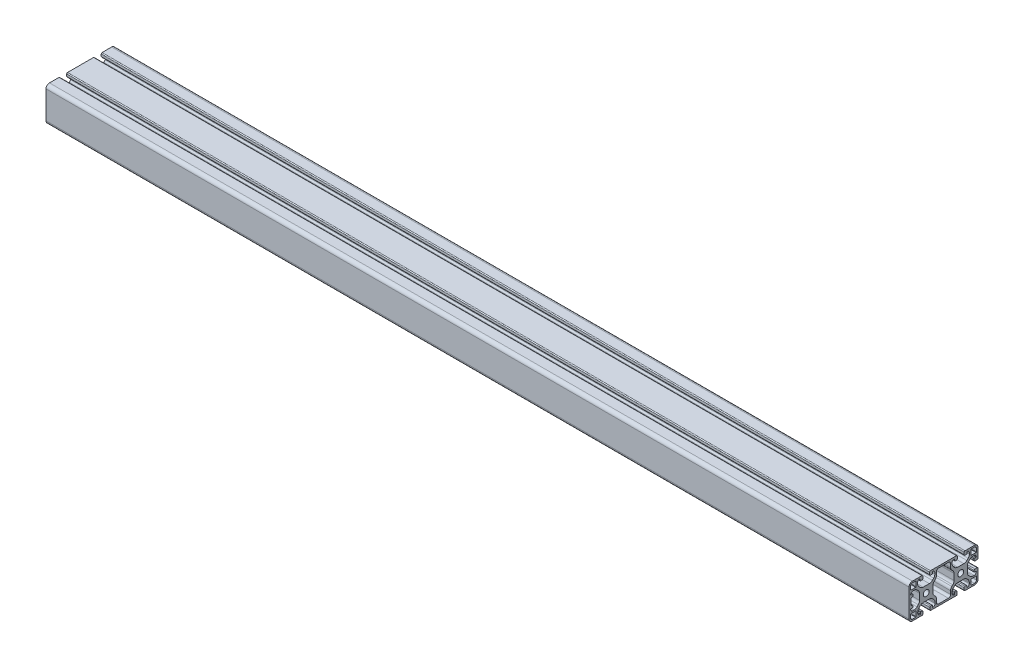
SolidWorks part; units mm, degrees
ref_plane "Ebene vorne" through (0, 0, 0) normal (0, 0, 1) x (1, 0, 0)
ref_plane "Ebene oben" through (0, 0, 0) normal (0, 1, 0) x (1, 0, 0)
ref_plane "Ebene rechts" through (0, 0, 0) normal (1, 0, 0) x (0, 0, -1)
sketch "Skizze1" plane through (0, 0, 0) normal (0, 1, 0) x (1, 0, 0)
  line L0 (0, 0) -> (1000, 0)
  dimension "D1" = 1000
other "Strukturbauteil1"
ref_plane "Ebene1" through (0, 0, 0) normal (1, 0, 0) x (0, 0, -1)
sketch "Skizze11" plane through (0, 0, 0) normal (1, 0, 0) x (0, 0, -1)
  line L0 (-15.8539, -17.6112) -> (-15.8539, -19.11)
  line L1 (23.846, -17.4921) -> (23.846, -19.1092)
  line L2 (15.7426, -17.5) -> (15.7426, -19.11)
  line L3 (-23.9651, -17.5) -> (-23.9651, -19.11)
  line L4 (9.5184, -8.2142) -> (10.6394, -7.0931)
  line L5 (8.0539, -15.5) -> (8.0539, -11.7497)
  line L6 (-5.8461, -18) -> (5.5539, -18)
  line L7 (-8.3461, -11.7497) -> (-8.3461, -15.5)
  line L8 (-14.9639, -20) -> (14.8526, -20)
  line L9 (24.7368, -20) -> (35.8539, -20)
  line L11 (-37.8961, -3.505) -> (-37.8961, 3.505)
  line L12 (-10.9316, -7.0931) -> (-9.8106, -8.2142)
  line L13 (-12.3961, 3.5576) -> (-12.3961, -3.5576)
  line L14 (-9.8106, 8.2142) -> (-10.9316, 7.0931)
  line L15 (-8.3461, 15.5) -> (-8.3461, 11.7497)
  line L16 (5.5539, 18) -> (-5.8461, 18)
  line L17 (8.0539, 11.7497) -> (8.0539, 15.5)
  line L18 (10.6394, 7.0931) -> (9.5184, 8.2142)
  line L19 (12.1039, -3.5576) -> (12.1039, 3.5576)
  line L24 (23.3003, -7.75) -> (16.185, -7.75)
  line L25 (37.5539, -11.8) -> (32.1539, -11.8)
  line L26 (-32.4461, -11.8) -> (-37.8461, -11.8)
  line L27 (-40.1461, 16) -> (-40.1461, -16)
  line L28 (-36.1461, -20) -> (-24.8551, -20)
  line L29 (39.8539, -16) -> (39.8539, -5)
  line L30 (38.8539, -4) -> (36.3539, -4)
  line L31 (35.3539, -5) -> (35.3539, -6.5)
  line L32 (35.8539, -7) -> (37.4039, -7)
  line L33 (37.8539, -7.45) -> (37.8539, -7.5)
  line L34 (35.3539, -10) -> (34.0463, -10)
  line L35 (30.5107, -8.5355) -> (29.0684, -7.0931)
  line L36 (27.6039, -3.5576) -> (27.6039, 3.5576)
  line L37 (29.0684, 7.0931) -> (30.5107, 8.5355)
  line L38 (34.0463, 10) -> (35.3539, 10)
  line L39 (37.8539, 7.5) -> (37.8539, 7.45)
  line L40 (37.4039, 7) -> (35.8539, 7)
  line L41 (35.3539, 6.5) -> (35.3539, 5)
  line L42 (36.3539, 4) -> (38.8539, 4)
  line L43 (39.8539, 5) -> (39.8539, 16)
  line L44 (35.8539, 20) -> (24.8539, 20)
  line L45 (23.8539, 19) -> (23.8539, 16.5)
  line L46 (24.8539, 15.5) -> (26.3539, 15.5)
  line L47 (26.8539, 16) -> (26.8539, 17.55)
  line L48 (27.3039, 18) -> (27.3539, 18)
  line L49 (29.8539, 15.5) -> (29.8539, 14.1924)
  line L50 (28.3894, 10.6569) -> (26.947, 9.2145)
  line L51 (23.4115, 7.75) -> (16.2963, 7.75)
  line L52 (12.7607, 9.2145) -> (11.3184, 10.6569)
  line L53 (9.8539, 14.1924) -> (9.8539, 15.5)
  line L54 (12.3539, 18) -> (12.4039, 18)
  line L55 (12.8539, 17.55) -> (12.8539, 16)
  line L56 (13.3539, 15.5) -> (14.8539, 15.5)
  line L57 (15.8539, 16.5) -> (15.8539, 19)
  line L58 (14.8539, 20) -> (-15.1461, 20)
  line L59 (-16.1461, 19) -> (-16.1461, 16.5)
  line L60 (-15.1461, 15.5) -> (-13.6461, 15.5)
  line L61 (-13.1461, 16) -> (-13.1461, 17.55)
  line L62 (-12.6961, 18) -> (-12.6461, 18)
  line L63 (-10.1461, 15.5) -> (-10.1461, 14.1924)
  line L64 (-11.6106, 10.6569) -> (-13.053, 9.2145)
  line L65 (-16.5885, 7.75) -> (-23.7037, 7.75)
  line L66 (-27.2392, 9.2145) -> (-28.6816, 10.6569)
  line L67 (-30.1461, 14.1924) -> (-30.1461, 15.5)
  line L68 (-27.6461, 18) -> (-27.5961, 18)
  line L69 (-27.1461, 17.55) -> (-27.1461, 16)
  line L70 (-26.6461, 15.5) -> (-25.1461, 15.5)
  line L71 (-24.1461, 16.5) -> (-24.1461, 19)
  line L72 (-25.1461, 20) -> (-36.1461, 20)
  line L74 (-37.4561, 3.945) -> (-36.6461, 3.945)
  line L75 (-35.6461, 4.945) -> (-35.6461, 6.445)
  line L76 (-36.1461, 6.945) -> (-37.6961, 6.945)
  line L77 (-38.1461, 7.395) -> (-38.1461, 7.445)
  line L78 (-35.6461, 9.945) -> (-34.3385, 9.945)
  line L79 (-30.803, 8.4805) -> (-29.3606, 7.0381)
  line L80 (-27.8961, 3.6126) -> (-27.8961, -3.5026)
  line L81 (-29.3606, -7.0381) -> (-30.803, -8.4805)
  line L82 (-34.3385, -9.945) -> (-35.6461, -9.945)
  line L83 (-38.1461, -7.445) -> (-38.1461, -7.395)
  line L84 (-37.6961, -6.945) -> (-36.1461, -6.945)
  line L85 (-35.6461, -6.445) -> (-35.6461, -4.945)
  line L86 (-36.6461, -3.945) -> (-37.4561, -3.945)
  line L87 (-14.8539, -15.6112) -> (-13.3539, -15.6112)
  line L88 (-29.9651, -14.1924) -> (-29.9651, -15.5)
  line L89 (-27.0583, -9.2145) -> (-28.5007, -10.6569)
  line L90 (-16.4075, -7.75) -> (-23.5228, -7.75)
  line L91 (-11.4296, -10.6569) -> (-12.872, -9.2145)
  line L92 (-9.9651, -15.5) -> (-9.9651, -14.1924)
  line L93 (-12.8539, -16.1112) -> (-12.8539, -17.6112)
  line L95 (-15.8539, -17.6112) -> (-15.8539, -16.6112)
  line L96 (-23.9651, -16.5) -> (-23.9651, -17.5)
  line L97 (-26.4651, -15.5) -> (-24.9651, -15.5)
  line L98 (-26.9651, -17.5) -> (-26.9651, -16)
  line L99 (31.6539, -12.3) -> (31.6539, -17.7)
  line L100 (9.7426, -14.1924) -> (9.7426, -15.5)
  line L101 (12.6495, -9.2145) -> (11.2071, -10.6569)
  line L103 (28.2782, -10.6569) -> (26.8358, -9.2145)
  line L104 (29.7426, -15.5) -> (29.7426, -14.1924)
  line L105 (26.846, -15.9921) -> (26.846, -17.4921)
  line L106 (24.846, -15.4921) -> (26.346, -15.4921)
  line L107 (23.846, -17.4921) -> (23.846, -16.4921)
  line L108 (15.7426, -16.5) -> (15.7426, -17.5)
  line L109 (13.2426, -15.5) -> (14.7426, -15.5)
  line L110 (12.7426, -17.5) -> (12.7426, -16)
  line L112 (38.0539, -16) -> (38.0539, -12.3)
  line L113 (32.1539, -18.2) -> (35.8539, -18.2)
  line L114 (-38.3461, 16) -> (-38.3461, 12.3)
  line L115 (-32.4461, 18.2) -> (-36.1461, 18.2)
  line L116 (-31.9461, 12.3) -> (-31.9461, 17.7)
  line L117 (-37.8461, 11.8) -> (-32.4461, 11.8)
  line L118 (31.6539, 17.7) -> (31.6539, 12.3)
  line L119 (35.8539, 18.2) -> (32.1539, 18.2)
  line L120 (38.0539, 12.3) -> (38.0539, 16)
  line L121 (32.1539, 11.8) -> (37.5539, 11.8)
  line L123 (-31.9461, -17.7) -> (-31.9461, -12.3)
  line L124 (-36.1461, -18.2) -> (-32.4461, -18.2)
  line L125 (-38.3461, -12.3) -> (-38.3461, -16)
  arc A0 (-37.4561, 3.945) -> (-37.8961, 3.505) centre (-37.4039, 3.4528) ccw
  arc A1 (-37.4561, -3.945) -> (-37.8961, -3.505) centre (-37.4039, -3.4528) cw
  arc A2 (14.8526, -20) -> (15.7426, -19.11) centre (14.747, -19.0043) ccw
  arc A3 (24.7368, -20) -> (23.846, -19.1092) centre (24.7368, -19.1092) cw
  arc A4 (-23.9651, -19.11) -> (-24.8551, -20) centre (-24.9608, -19.0043) cw
  arc A5 (-14.9639, -20) -> (-15.8539, -19.11) centre (-14.8582, -19.0043) cw
  arc A6 (10.6394, -7.0931) -> (12.1039, -3.5576) centre (7.1039, -3.5576) ccw
  arc A7 (9.5184, -8.2142) -> (8.0539, -11.7497) centre (13.0539, -11.7497) ccw
  arc A8 (5.5539, -18) -> (8.0539, -15.5) centre (5.5539, -15.5) ccw
  arc A9 (-8.3461, -15.5) -> (-5.8461, -18) centre (-5.8461, -15.5) ccw
  arc A11 (-12.3961, -3.5576) -> (-10.9316, -7.0931) centre (-7.3961, -3.5576) ccw
  arc A12 (-8.3461, -11.7497) -> (-9.8106, -8.2142) centre (-13.3461, -11.7497) ccw
  arc A14 (-10.9316, 7.0931) -> (-12.3961, 3.5576) centre (-7.3961, 3.5576) ccw
  arc A15 (-9.8106, 8.2142) -> (-8.3461, 11.7497) centre (-13.3461, 11.7497) ccw
  arc A16 (-5.8461, 18) -> (-8.3461, 15.5) centre (-5.8461, 15.5) ccw
  arc A17 (8.0539, 15.5) -> (5.5539, 18) centre (5.5539, 15.5) ccw
  arc A18 (8.0539, 11.7497) -> (9.5184, 8.2142) centre (13.0539, 11.7497) ccw
  arc A19 (12.1039, 3.5576) -> (10.6394, 7.0931) centre (7.1039, 3.5576) ccw
  circle A24 centre (-20.1461, 0) radius 3.4
  circle A25 centre (19.8539, 0) radius 3.4
  arc A26 (16.185, -7.75) -> (12.6495, -9.2145) centre (16.185, -12.75) ccw
  arc A27 (-40.1461, -16) -> (-36.1461, -20) centre (-36.1461, -16) ccw
  arc A28 (35.8539, -20) -> (39.8539, -16) centre (35.8539, -16) ccw
  arc A29 (39.8539, -5) -> (38.8539, -4) centre (38.8539, -5) ccw
  arc A30 (36.3539, -4) -> (35.3539, -5) centre (36.3539, -5) ccw
  arc A31 (35.3539, -6.5) -> (35.8539, -7) centre (35.8539, -6.5) ccw
  arc A32 (37.8539, -7.45) -> (37.4039, -7) centre (37.4039, -7.45) ccw
  arc A33 (35.3539, -10) -> (37.8539, -7.5) centre (35.3539, -7.5) ccw
  arc A34 (30.5107, -8.5355) -> (34.0463, -10) centre (34.0463, -5) ccw
  arc A35 (27.6039, -3.5576) -> (29.0684, -7.0931) centre (32.6039, -3.5576) ccw
  arc A36 (29.0684, 7.0931) -> (27.6039, 3.5576) centre (32.6039, 3.5576) ccw
  arc A37 (34.0463, 10) -> (30.5107, 8.5355) centre (34.0463, 5) ccw
  arc A38 (37.8539, 7.5) -> (35.3539, 10) centre (35.3539, 7.5) ccw
  arc A39 (37.4039, 7) -> (37.8539, 7.45) centre (37.4039, 7.45) ccw
  arc A40 (35.8539, 7) -> (35.3539, 6.5) centre (35.8539, 6.5) ccw
  arc A41 (35.3539, 5) -> (36.3539, 4) centre (36.3539, 5) ccw
  arc A42 (38.8539, 4) -> (39.8539, 5) centre (38.8539, 5) ccw
  arc A43 (39.8539, 16) -> (35.8539, 20) centre (35.8539, 16) ccw
  arc A44 (24.8539, 20) -> (23.8539, 19) centre (24.8539, 19) ccw
  arc A45 (23.8539, 16.5) -> (24.8539, 15.5) centre (24.8539, 16.5) ccw
  arc A46 (26.3539, 15.5) -> (26.8539, 16) centre (26.3539, 16) ccw
  arc A47 (27.3039, 18) -> (26.8539, 17.55) centre (27.3039, 17.55) ccw
  arc A48 (29.8539, 15.5) -> (27.3539, 18) centre (27.3539, 15.5) ccw
  arc A49 (28.3894, 10.6569) -> (29.8539, 14.1924) centre (24.8539, 14.1924) ccw
  arc A50 (23.4115, 7.75) -> (26.947, 9.2145) centre (23.4115, 12.75) ccw
  arc A51 (12.7607, 9.2145) -> (16.2963, 7.75) centre (16.2963, 12.75) ccw
  arc A52 (9.8539, 14.1924) -> (11.3184, 10.6569) centre (14.8539, 14.1924) ccw
  arc A53 (12.3539, 18) -> (9.8539, 15.5) centre (12.3539, 15.5) ccw
  arc A54 (12.8539, 17.55) -> (12.4039, 18) centre (12.4039, 17.55) ccw
  arc A55 (12.8539, 16) -> (13.3539, 15.5) centre (13.3539, 16) ccw
  arc A56 (14.8539, 15.5) -> (15.8539, 16.5) centre (14.8539, 16.5) ccw
  arc A57 (15.8539, 19) -> (14.8539, 20) centre (14.8539, 19) ccw
  arc A58 (-15.1461, 20) -> (-16.1461, 19) centre (-15.1461, 19) ccw
  arc A59 (-16.1461, 16.5) -> (-15.1461, 15.5) centre (-15.1461, 16.5) ccw
  arc A60 (-13.6461, 15.5) -> (-13.1461, 16) centre (-13.6461, 16) ccw
  arc A61 (-12.6961, 18) -> (-13.1461, 17.55) centre (-12.6961, 17.55) ccw
  arc A62 (-10.1461, 15.5) -> (-12.6461, 18) centre (-12.6461, 15.5) ccw
  arc A63 (-11.6106, 10.6569) -> (-10.1461, 14.1924) centre (-15.1461, 14.1924) ccw
  arc A64 (-16.5885, 7.75) -> (-13.053, 9.2145) centre (-16.5885, 12.75) ccw
  arc A65 (-27.2392, 9.2145) -> (-23.7037, 7.75) centre (-23.7037, 12.75) ccw
  arc A66 (-30.1461, 14.1924) -> (-28.6816, 10.6569) centre (-25.1461, 14.1924) ccw
  arc A67 (-27.6461, 18) -> (-30.1461, 15.5) centre (-27.6461, 15.5) ccw
  arc A68 (-27.1461, 17.55) -> (-27.5961, 18) centre (-27.5961, 17.55) ccw
  arc A69 (-27.1461, 16) -> (-26.6461, 15.5) centre (-26.6461, 16) ccw
  arc A70 (-25.1461, 15.5) -> (-24.1461, 16.5) centre (-25.1461, 16.5) ccw
  arc A71 (-24.1461, 19) -> (-25.1461, 20) centre (-25.1461, 19) ccw
  arc A72 (-36.1461, 20) -> (-40.1461, 16) centre (-36.1461, 16) ccw
  arc A73 (-36.6461, 3.945) -> (-35.6461, 4.945) centre (-36.6461, 4.945) ccw
  arc A74 (-35.6461, 6.445) -> (-36.1461, 6.945) centre (-36.1461, 6.445) ccw
  arc A75 (-38.1461, 7.395) -> (-37.6961, 6.945) centre (-37.6961, 7.395) ccw
  arc A76 (-35.6461, 9.945) -> (-38.1461, 7.445) centre (-35.6461, 7.445) ccw
  arc A77 (-30.803, 8.4805) -> (-34.3385, 9.945) centre (-34.3385, 4.945) ccw
  arc A78 (-27.8961, 3.6126) -> (-29.3606, 7.0381) centre (-32.8949, 3.5014) ccw
  arc A79 (-29.3606, -7.0381) -> (-27.8961, -3.5026) centre (-32.8961, -3.5026) ccw
  arc A80 (-34.3385, -9.945) -> (-30.803, -8.4805) centre (-34.3385, -4.945) ccw
  arc A81 (-38.1461, -7.445) -> (-35.6461, -9.945) centre (-35.6461, -7.445) ccw
  arc A82 (-37.6961, -6.945) -> (-38.1461, -7.395) centre (-37.6961, -7.395) ccw
  arc A83 (-36.1461, -6.945) -> (-35.6461, -6.445) centre (-36.1461, -6.445) ccw
  arc A84 (-35.6461, -4.945) -> (-36.6461, -3.945) centre (-36.6461, -4.945) ccw
  arc A85 (-14.8539, -15.6112) -> (-15.8539, -16.6112) centre (-14.8539, -16.6112) ccw
  arc A86 (31.6539, -17.7) -> (32.1539, -18.2) centre (32.1539, -17.7) ccw
  arc A87 (32.1539, -11.8) -> (31.6539, -12.3) centre (32.1539, -12.3) ccw
  arc A88 (38.0539, -12.3) -> (37.5539, -11.8) centre (37.5539, -12.3) ccw
  arc A89 (35.8539, -18.2) -> (38.0539, -16) centre (35.8539, -16) ccw
  arc A90 (-29.9651, -15.5) -> (-27.4651, -18) centre (-27.4651, -15.5) ccw
  arc A91 (-28.5007, -10.6569) -> (-29.9651, -14.1924) centre (-24.9651, -14.1924) ccw
  arc A92 (-23.5228, -7.75) -> (-27.0583, -9.2145) centre (-23.5228, -12.75) ccw
  arc A93 (-12.872, -9.2145) -> (-16.4075, -7.75) centre (-16.4075, -12.75) ccw
  arc A94 (-9.9651, -14.1924) -> (-11.4296, -10.6569) centre (-14.9651, -14.1924) ccw
  arc A95 (-12.3539, -18.1112) -> (-9.9651, -15.5) centre (-12.4626, -15.6136) ccw
  arc A96 (-12.8539, -17.6112) -> (-12.3539, -18.1112) centre (-12.3539, -17.6112) ccw
  arc A97 (-12.8539, -16.1112) -> (-13.3539, -15.6112) centre (-13.3539, -16.1112) ccw
  arc A99 (-23.9651, -16.5) -> (-24.9651, -15.5) centre (-24.9651, -16.5) ccw
  arc A100 (-26.4651, -15.5) -> (-26.9651, -16) centre (-26.4651, -16) ccw
  arc A101 (-27.4651, -18) -> (-26.9651, -17.5) centre (-27.4651, -17.5) ccw
  arc A102 (9.7426, -15.5) -> (12.2426, -18) centre (12.2426, -15.5) ccw
  arc A103 (11.2071, -10.6569) -> (9.7426, -14.1924) centre (14.7426, -14.1924) ccw
  arc A105 (26.8358, -9.2145) -> (23.3003, -7.75) centre (23.3003, -12.75) ccw
  arc A106 (29.7426, -14.1924) -> (28.2782, -10.6569) centre (24.7426, -14.1924) ccw
  arc A107 (27.346, -17.9921) -> (29.7426, -15.5) centre (27.2427, -15.4942) ccw
  arc A108 (26.846, -17.4921) -> (27.346, -17.9921) centre (27.346, -17.4921) ccw
  arc A109 (26.846, -15.9921) -> (26.346, -15.4921) centre (26.346, -15.9921) ccw
  arc A110 (24.846, -15.4921) -> (23.846, -16.4921) centre (24.846, -16.4921) ccw
  arc A111 (15.7426, -16.5) -> (14.7426, -15.5) centre (14.7426, -16.5) ccw
  arc A112 (13.2426, -15.5) -> (12.7426, -16) centre (13.2426, -16) ccw
  arc A113 (12.2426, -18) -> (12.7426, -17.5) centre (12.2426, -17.5) ccw
  arc A114 (-38.3461, 12.3) -> (-37.8461, 11.8) centre (-37.8461, 12.3) ccw
  arc A115 (-36.1461, 18.2) -> (-38.3461, 16) centre (-36.1461, 16) ccw
  arc A116 (-31.9461, 17.7) -> (-32.4461, 18.2) centre (-32.4461, 17.7) ccw
  arc A117 (-32.4461, 11.8) -> (-31.9461, 12.3) centre (-32.4461, 12.3) ccw
  arc A118 (31.6539, 12.3) -> (32.1539, 11.8) centre (32.1539, 12.3) ccw
  arc A119 (32.1539, 18.2) -> (31.6539, 17.7) centre (32.1539, 17.7) ccw
  arc A120 (38.0539, 16) -> (35.8539, 18.2) centre (35.8539, 16) ccw
  arc A121 (37.5539, 11.8) -> (38.0539, 12.3) centre (37.5539, 12.3) ccw
  arc A122 (-37.8461, -11.8) -> (-38.3461, -12.3) centre (-37.8461, -12.3) ccw
  arc A123 (-31.9461, -12.3) -> (-32.4461, -11.8) centre (-32.4461, -12.3) ccw
  arc A124 (-32.4461, -18.2) -> (-31.9461, -17.7) centre (-32.4461, -17.7) ccw
  arc A125 (-38.3461, -16) -> (-36.1461, -18.2) centre (-36.1461, -16) ccw
  point P1 (-37.4561, 3.945)
  point P2 (19.8539, -20)
  point P8 (14.8526, -20)
  point P87 (-37.8961, 3.505)
  point P142 (-20.1461, -20)
  point P144 (-37.4561, -3.945)
  point P156 (-37.8961, -3.505)
  point P262 (15.7426, -19.11)
  point P264 (24.736, -20)
  point P283 (23.846, -19.11)
  point P284 (-14.9639, -20)
  point P298 (-15.8539, -19.11)
  point P300 (-24.8551, -20)
  point P312 (-40.1461, 0)
  point P319 (-23.9651, -19.11)
  point P360 (-40.1461, -20)
  point P362 (-40.1461, 20)
  point P369 (0, 0)
  point P370 (-20.1461, 20)
  point P371 (19.8539, 20)
  point P372 (39.8539, 0)
  point P373 (19.8539, 0)
  point P374 (-20.1461, 0)
  point P375 (39.8539, -20)
  point P376 (39.8539, 20)
  point P377 (-0.0556, -20)
  point P378 (-0.1461, 20)
  point P379 (0, 0)
  dimension "D2" = 0.44
  dimension "D6" = 0.89
  dimension "D7" = 0.89
  dimension "D1" = 0.44
  dimension "D3" = 0.44
  dimension "D4" = 0.44
  dimension "D5" = 0.89
  dimension "D8" = 0.89
  dimension "D9" = 0.89
  dimension "D10" = 0.89
  dimension "D11" = 0.89
  dimension "D12" = 0.89
